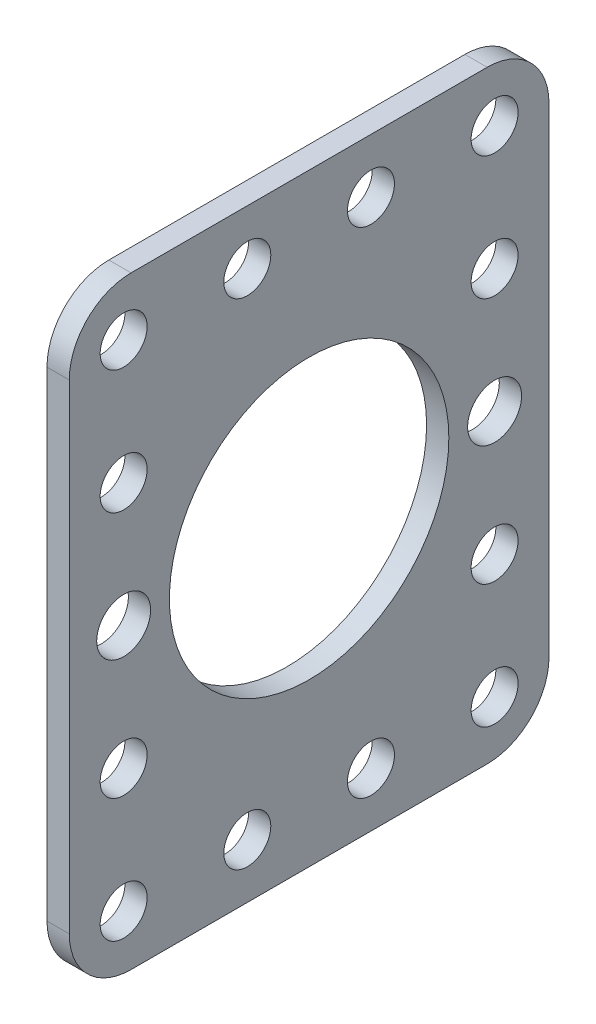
SolidWorks part; units mm, degrees
ref_plane "Front" through (0, 0, 0) normal (0, 0, 1) x (1, 0, 0)
ref_plane "Top" through (0, 0, 0) normal (0, 1, 0) x (1, 0, 0)
ref_plane "Right" through (0, 0, 0) normal (1, 0, 0) x (0, 0, -1)
sketch "Sketch1" plane through (0, 0, 0) normal (1, 0, 0) x (0, 0, -1)
  line L0 (24.638, -30.988) -> (-24.638, 30.988) construction
  line L1 (-18.288, -30.988) -> (18.288, -30.988)
  line L2 (-24.638, -24.638) -> (-24.638, 24.638)
  line L3 (-18.288, 30.988) -> (18.288, 30.988)
  line L4 (24.638, -24.638) -> (24.638, 24.638)
  circle A0 centre (0, 0) radius 14.351
  arc A1 (18.288, -30.988) -> (24.638, -24.638) centre (18.288, -24.638) ccw
  arc A2 (-18.288, -30.988) -> (-24.638, -24.638) centre (-18.288, -24.638) cw
  arc A3 (-24.638, 24.638) -> (-18.288, 30.988) centre (-18.288, 24.638) cw
  arc A4 (18.288, 30.988) -> (24.638, 24.638) centre (18.288, 24.638) cw
  point P16 (24.638, 30.988)
  dimension "D1" = 28.702
  dimension "D4" = 6.35
  dimension "D2" = 49.276
  dimension "D3" = 61.976
extrude "Extrude1" add sketch "Sketch1" along normal blind 2.286
sketch "Sketch2" plane through (2.286, 0, 0) normal (1, 0, 0) x (0, 0, -1)
  circle A0 centre (-19.05, -25.4) radius 2.413
  dimension "D1" = 4.826
  dimension "D2" = 19.05
  dimension "D3" = 25.4
extrude "Cut-Extrude1" cut sketch "Sketch2" against normal through all
pattern_linear "LPattern1" count 4 spacing 12.7 count 5 spacing 12.7
sketch "Sketch3" plane through (2.286, 0, 0) normal (1, 0, 0) x (0, 0, -1)
  line L0 (0, 0) -> (0, -43.8016) construction
  circle A0 centre (19.05, 0) radius 2.7686
  circle A1 centre (-19.05, 0) radius 2.7686
  dimension "D1" = 5.5372
  dimension "D2" = 19.05
extrude "Cut-Extrude2" cut sketch "Sketch3" against normal through all
